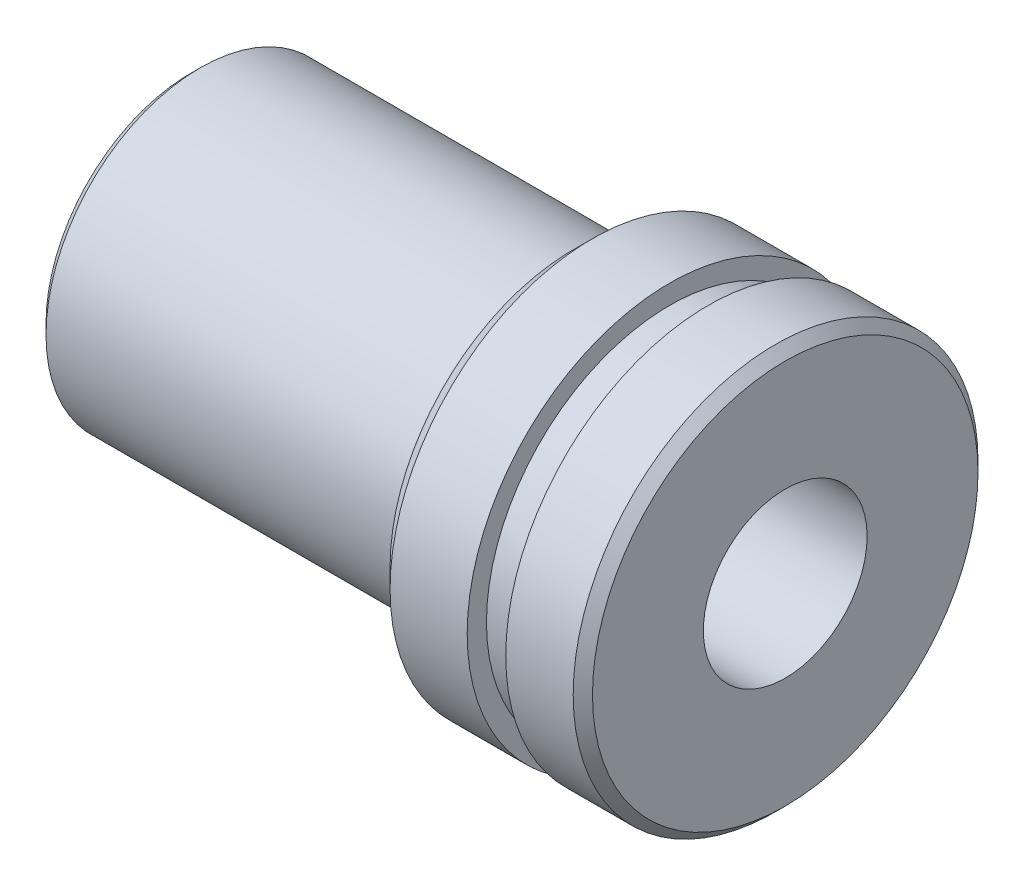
SolidWorks part; units mm, degrees
ref_plane "Plan1" through (0, 0, 0) normal (0, 0, 1) x (1, 0, 0)
ref_plane "Plan2" through (0, 0, 0) normal (0, 1, 0) x (1, 0, 0)
ref_plane "Plan3" through (0, 0, 0) normal (1, 0, 0) x (0, 0, -1)
sketch "Esquisse1" plane through (0, 0, 0) normal (0, 0, 1) x (1, 0, 0)
  line L0 (0, 4.25) -> (-30.85, 4.25)
  line L1 (-30.85, 4.25) -> (-30.85, 8)
  line L2 (-30.85, 8) -> (-11, 8)
  line L3 (-11, 8) -> (-11, 10.5)
  line L4 (-11, 10.5) -> (-6, 10.5)
  line L5 (-6, 10.5) -> (-6, 9.5)
  line L6 (-6, 9.5) -> (-4, 9.5)
  line L7 (-4, 9.5) -> (-4, 10.5)
  line L8 (-4, 10.5) -> (0, 10.5)
  line L9 (0, 10.5) -> (0, 4.25)
  line L10 (9, 0) -> (-37, 0) construction
  dimension "D1" = 8.5
  dimension "D2" = 21
  dimension "D3" = 19
  dimension "D4" = 16
  dimension "D5" = 30.85
  dimension "D6" = 5
  dimension "D7" = 2
  dimension "D8" = 11
revolve "Base-Révolution" add sketch "Esquisse1"
extrude "rainure" cut sketch "Esquisse3" against normal through all and the other way through all
sketch "Esquisse3" plane through (0, 0, 0) normal (0, 0, 1) x (1, 0, 0)
  line L0 (-30.85, 0.3) -> (-25.75, 0.3)
  line L1 (-30.85, 8) -> (-30.85, -8) construction
  line L2 (-25.75, 0.3) -> (-25.75, 3.1)
  line L3 (-25.75, 3.1) -> (-30.85, 3.1)
  dimension "D1" = 5.1
  dimension "D2" = 2.8
  dimension "D3" = 0.3
chamfer "Chanfrein1" distance 1 distance2 1
chamfer "Chanfrein2" distance 0.5 angle 45
sketch "Esquisse5" plane through (0, 0, 0) normal (1, 0, 0) x (0, 0, -1)
  circle A0 centre (0, 0) radius 4.25
chamfer "Chanfrein3" distance 0.5 angle 45
chamfer "Chanfrein4" [suppressed] distance 1 angle 45
chamfer "Chanfrein5" [suppressed] distance 1 angle 45
chamfer "Chanfrein6" distance 1 angle 45
